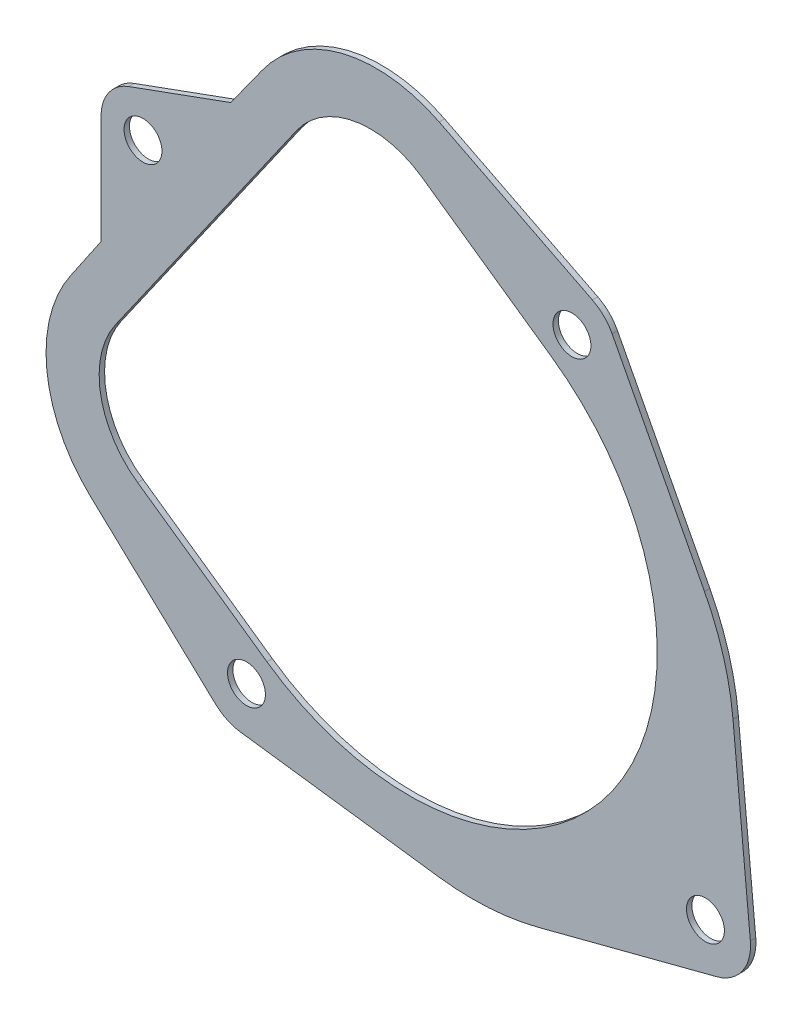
SolidWorks part; units mm, degrees
ref_plane "Plane1" through (0, 0, 0) normal (0, 0, 1) x (1, 0, 0)
ref_plane "Plane2" through (0, 0, 0) normal (0, 1, 0) x (1, 0, 0)
ref_plane "Plane3" through (0, 0, 0) normal (1, 0, 0) x (0, 0, -1)
sketch "Esquisse1" plane through (0, 0, 0) normal (0, 0, 1) x (1, 0, 0)
  line L0 (35.6153, -25.6722) -> (33.6905, -5.3557)
  line L1 (27.6319, 39.4624) -> (-27.5325, -39.3205) construction
  line L2 (-21.9864, 26.0072) -> (-33.3071, 21.8868)
  line L3 (-34.7684, -1.7096) -> (-14.6932, 26.9607)
  line L4 (-37.5666, -19.5572) -> (-23.6827, -32.5788)
  line L5 (-20.9075, -33.8943) -> (1.0282, -36.8054)
  line L6 (-39.6617, 0.6364) -> (-36.3668, 5.4699)
  line L7 (-18.5714, 30.7566) -> (-21.9864, 26.0072)
  line L8 (20.2912, 24.9436) -> (30.5292, 5.3264)
  line L9 (1.121, 35.6944) -> (18.1059, 27.1014)
  line L10 (39.8277, -32.5788) -> (-42.3227, 24.9436) construction
  line L11 (13.5692, 19.3789) -> (-0.7659, 29.4165)
  line L12 (-17.9775, -25.6745) -> (-32.3126, -15.6369)
  line L16 (-36.3668, 5.4699) -> (-36.3668, 17.5171)
  line L17 (31.8969, -30.9826) -> (12.1474, -36.1225)
  arc A0 (30.5292, 5.3264) -> (33.6905, -5.3557) centre (4.8198, -8.091) cw
  arc A1 (-18.5714, 30.7566) -> (1.121, 35.6944) centre (-5.8762, 21.8637) cw
  arc A2 (35.6153, -25.6722) -> (31.8969, -30.9826) centre (30.6376, -26.1438) cw
  arc A3 (-33.3071, 21.8868) -> (-36.3668, 17.5171) centre (-31.7166, 17.5171) ccw
  arc A4 (20.2912, 24.9436) -> (18.1059, 27.1014) centre (15.8385, 22.6198) ccw
  circle A5 centre (15.8385, 22.6198) radius 2.1
  arc A6 (-20.9075, -33.8943) -> (-23.6827, -32.5788) centre (-20.2468, -28.9154) cw
  circle A7 centre (-31.7166, 17.5171) radius 2.1
  circle A8 centre (-20.2468, -28.9154) radius 2.1
  circle A9 centre (30.6376, -26.1438) radius 2.1
  arc A10 (-17.9775, -25.6745) -> (13.5692, 19.3789) centre (-2.2041, -3.1478) ccw
  arc A11 (-14.6932, 26.9607) -> (-0.7659, 29.4165) centre (-6.5017, 21.225) cw
  arc A12 (-39.6617, 0.6364) -> (-37.5666, -19.5572) centre (-26.9632, -8.2516) ccw
  arc A13 (1.0282, -36.8054) -> (12.1474, -36.1225) centre (4.8433, -8.0574) ccw
  arc A14 (-32.3126, -15.6369) -> (-34.7684, -1.7096) centre (-26.5769, -7.4454) cw
  dimension "D1" = 4.2
  dimension "D2" = 4.2
  dimension "D3" = 4.2
  dimension "D4" = 4.2
  dimension "D5" = 55
  dimension "D6" = 10
extrude "Base-Extrusion" add sketch "Esquisse1" along normal mid plane 0.6
